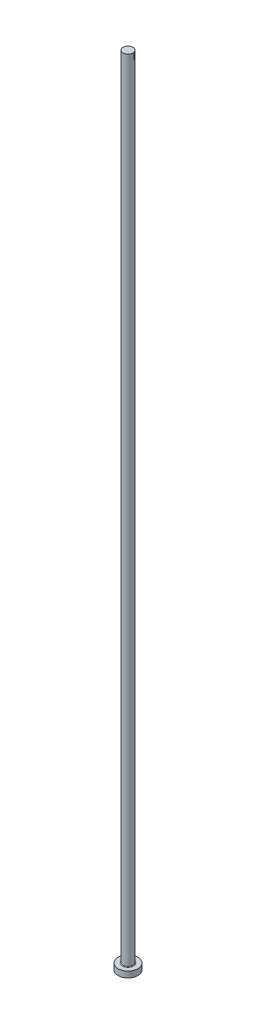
SolidWorks part; units mm, degrees
ref_plane "Plano frontal" through (0, 0, 0) normal (0, 0, 1) x (1, 0, 0)
ref_plane "Plano superior" through (0, 0, 0) normal (0, 1, 0) x (1, 0, 0)
ref_plane "Plano direito" through (0, 0, 0) normal (1, 0, 0) x (0, 0, -1)
sketch "Esboço1" plane through (0, 0, 0) normal (0, 0, 1) x (1, 0, 0)
  line L0 (0, 0) -> (5, 0)
  line L1 (5, 0) -> (5, 3)
  line L2 (5, 3) -> (2.8, 3)
  line L3 (2.5, 3.3) -> (2.5, 400)
  line L4 (2.5, 400) -> (0, 400)
  line L5 (0, 400) -> (0, 0) construction
  line L6 (0, 0) -> (0, 400)
  arc A0 (2.8, 3) -> (2.5, 3.3) centre (2.8, 3.3) cw
  dimension "D3" = 0.3
  dimension "D1" = 10
  dimension "D2" = 5
  dimension "D4" = 3
  dimension "D5" = 400
revolve "Revolução1" add sketch "Esboço1" angle 360 about L5
sketch "Esboço2"
  dimension "D1" = 0.375
  dimension "D2" = 0.875
  dimension "D3" = 0.5625
  dimension "D4" = 2.6875
wrap "Envolver1" sketch "Esboço2" wrap type deboss source sketch "Esboço2" thickness 0.1 parameters "D1"=0.1
